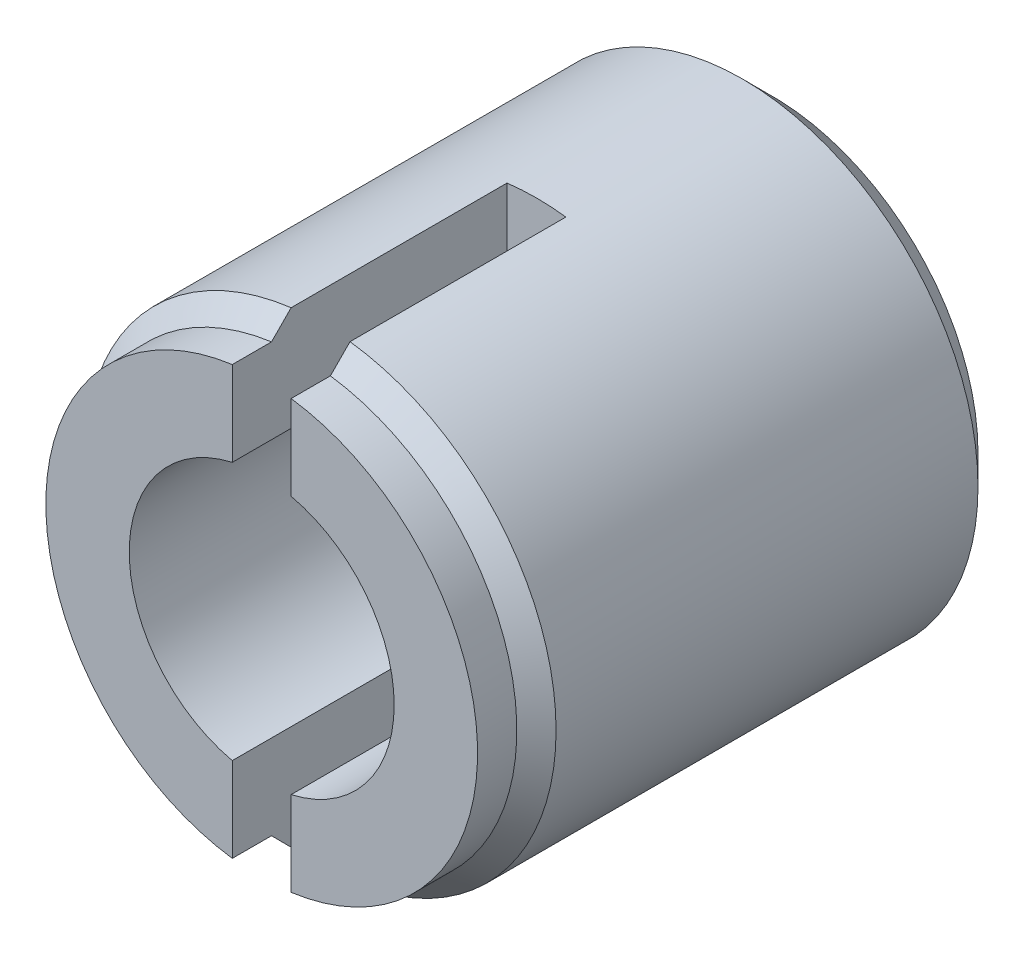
SolidWorks part; units mm, degrees
ref_plane "Face" through (0, 0, 0) normal (0, 0, 1) x (1, 0, 0)
ref_plane "Dessus" through (0, 0, 0) normal (0, 1, 0) x (1, 0, 0)
ref_plane "Droite" through (0, 0, 0) normal (1, 0, 0) x (0, 0, -1)
sketch "Esquisse1" plane through (0, 0, 0) normal (0, 0, 1) x (1, 0, 0)
  circle A0 centre (0, 0) radius 6
  dimension "D1" = 12
extrude "Base-Extrusion" add sketch "Esquisse1" against normal blind 13
hole_wizard "Diamètre du perçage Ø6.7 (6.75)1" positions "Esquisse3" profile "Esquisse2" hole size "Ø6.7" standard "ISO"
sketch "Esquisse3" plane through (0, 0, 0) normal (0, 0, 1) x (1, 0, 0)
  circle A0 centre (0, 0) radius 6 construction
  point P0 (0, 0)
sketch "Esquisse2" plane through (0, 0, 0) normal (1, 0, 0) x (0, -1, 0)
  line L0 (0, 0) -> (0, 13)
  line L1 (0, 13) -> (3.375, 13)
  line L2 (3.375, 13) -> (3.375, 0)
  line L5 (3.375, 0) -> (0, 0)
  line L11 (0, -6.35) -> (0, 107.95) construction
  dimension "Diamètre du perçage jusqu'au prochain" = 6.75
  dimension "Profondeur du perçage jusqu'au prochain" = 13
chamfer "Chanfrein1" distance 0.75 angle 45 1 edges at (6, 0, -13)
thread "Filetage1" pitch 1.25 start angle 0, offset 5, length 20, pitch 1.25, diameter 6.75
ref_plane "Plan1" through (3.375, 0, -18) normal (0, -1, 0) x (1, 0, 0)
sketch "Profil de filetage1" plane through (3.375, 0, -18) normal (0, -1, 0) x (1, 0, 0)
  line L0 (0, 0) -> (0, 1.25) construction
  line L1 (0, 0) -> (0.6766, 0.3906)
  line L2 (0.6766, 0.3906) -> (0.6766, 0.5469)
  line L3 (0.6766, 0.5469) -> (0, 0.9375)
  line L4 (0.6766, 0.4687) -> (0, 0.4687) construction
  line L11 (0, 0) -> (0, 0.9375)
  point P2 (0, 0)
  dimension "Pitch" = 1.25
  dimension "Profile_Angle" = 60
  dimension "Profile_Land" = 0.1562
  dimension "Profile_Height" = 0.6766
sketch "Esquisse4" plane through (0, 0, 0) normal (0, 0, 1) x (1, 0, 0)
  circle A0 centre (0, 0) radius 5.5
  circle A1 centre (0, 0) radius 7.427
extrude "Enlèv. mat.-Extru.1" cut sketch "Esquisse4" against normal blind 1
chamfer "Chanfrein3" distance 0.5 angle 45 1 edges at (6, 0, -1)
sketch "Esquisse6" plane through (0, 0, 0) normal (0, 0, 1) x (1, 0, 0)
  line L0 (0, 6) -> (0, -6) construction
  line L1 (-0.75, 6.5) -> (0.75, 6.5)
  line L2 (-0.75, 6.5) -> (-0.75, -6.5)
  line L3 (-0.75, -6.5) -> (0.75, -6.5)
  line L4 (0.75, 6.5) -> (0.75, -6.5)
  line L5 (-3.375, 0) -> (3.375, 0) construction
  circle A0 centre (0, 0) radius 6 construction
  circle A1 centre (0, 0) radius 3.375 construction
  dimension "D1" = 1.5
  dimension "D2" = 13
extrude "Enlèv. mat.-Extru.2" cut sketch "Esquisse6" against normal blind 7
thread "Filetage2" pitch 1.5 start angle 0, offset 5, length 20, pitch 1.5, diameter 12
ref_plane "Plan2" through (6, 0, -17.25) normal (0, -1, 0) x (1, 0, 0)
sketch "Profil de filetage2" plane through (6, 0, -17.25) normal (0, -1, 0) x (1, 0, 0)
  line L0 (0, 0) -> (0, 1.5) construction
  line L11 (0, 0) -> (0, 1.3125)
  line L12 (0, 1.3125) -> (-0.8119, 0.8437)
  line L13 (-0.8119, 0.8437) -> (-0.8119, 0.4687)
  line L15 (-0.8119, 0.4687) -> (0, 0)
  line L17 (-0.8119, 0.6562) -> (0, 0.6562) construction
  point P2 (0, 0)
  dimension "Pitch" = 1.5
  dimension "Profile_Angle" = 60
  dimension "Profile_Land" = 0.375
  dimension "Profile_Height" = 0.8119
